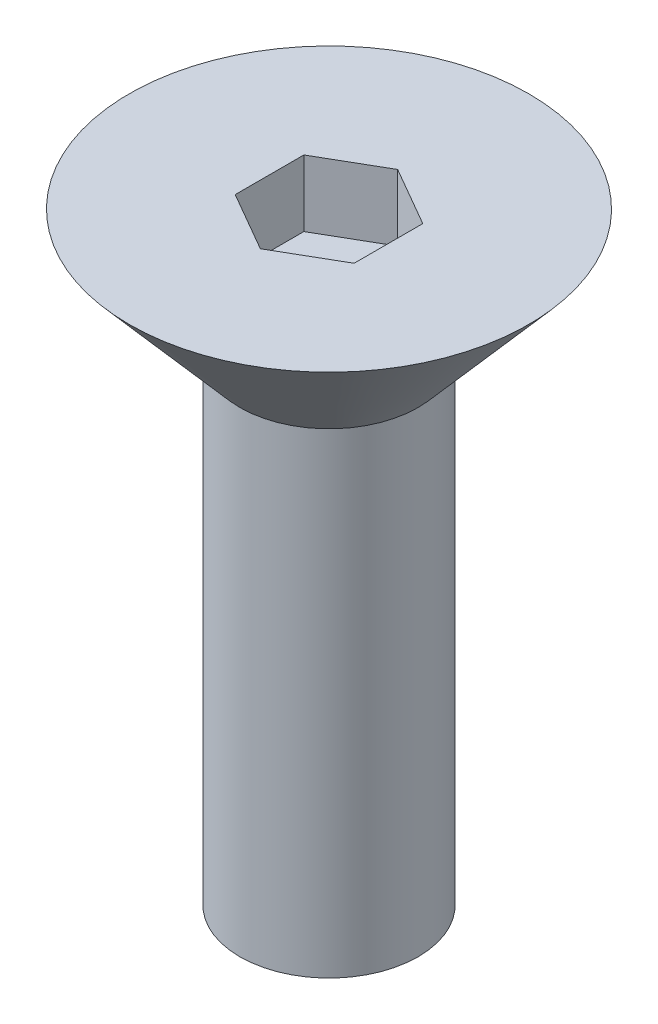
SolidWorks part; units mm, degrees
ref_plane "Plane1" through (0, 0, 0) normal (0, 0, 1) x (1, 0, 0)
ref_plane "Plane2" through (0, 0, 0) normal (0, 1, 0) x (1, 0, 0)
ref_plane "Plane3" through (0, 0, 0) normal (1, 0, 0) x (0, 0, -1)
sketch "Sketch1" plane through (0, 0, 0) normal (0, 0, 1) x (1, 0, 0)
  line L0 (0, 0) -> (3.36, 0)
  line L1 (1.5, -2.1397) -> (3.36, 0)
  line L4 (1.5, -2.1397) -> (1.5, -10.1397)
  line L5 (0, 25.4) -> (0, -50.8) construction
  line L6 (1.5, -10.1397) -> (0, -10.1397)
  line L7 (0, 0) -> (0, -10.1397)
revolve "Screw" add sketch "Sketch1" angle 360 about L5
sketch "Sketch2" plane through (0, 0, 0) normal (0, 1, 0) x (-1, 0, 0)
  line L0 (0, -5.08) -> (0, 5.08) construction
  line L1 (24.9225, 0) -> (-26.9225, 0) construction
  line L2 (-1, -0.5774) -> (-1, 0.5774)
  line L3 (0, 1.1547) -> (-1, 0.5774)
  line L4 (0, 1.1547) -> (1, 0.5774)
  line L5 (1, -0.5774) -> (1, 0.5774)
  line L6 (0, -1.1547) -> (-1, -0.5774)
  line L7 (0, -1.1547) -> (1, -0.5774)
  point P8 (-1, 0)
  dimension "D1" = 120
  dimension "HexWidth" = 2
extrude "HexCut" cut sketch "Sketch2" against normal blind 1.116
equation "\"HexDepth@HexCut\" =  ( \"HeadWidth@Sketch1\" - \"NominalDia@Sketch1\" )  *  .3"
